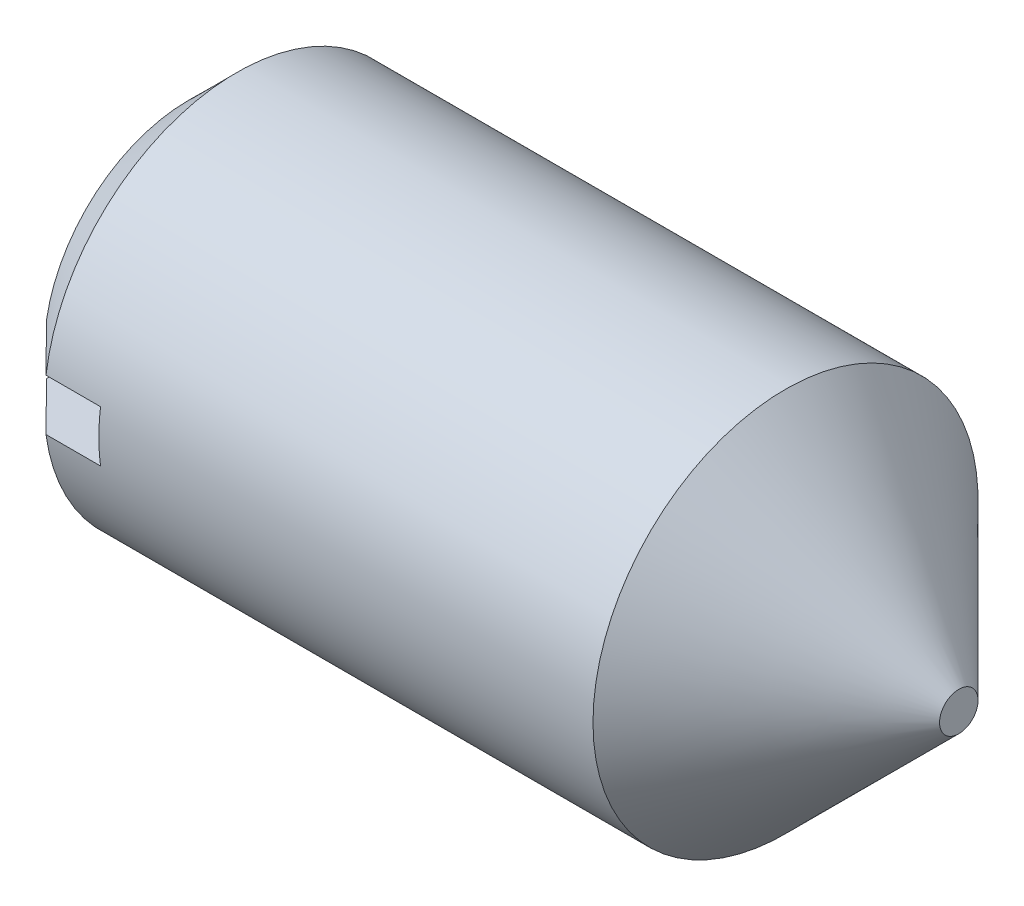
SolidWorks part; units mm, degrees
ref_plane "Front" through (0, 0, 0) normal (0, 0, 1) x (1, 0, 0)
ref_plane "Top" through (0, 0, 0) normal (0, 1, 0) x (1, 0, 0)
ref_plane "Right" through (0, 0, 0) normal (1, 0, 0) x (0, 0, -1)
sketch "Sketch1" plane through (0, 0, 0) normal (0, 0, 1) x (1, 0, 0)
  line L0 (0, 0) -> (6, 0)
  line L1 (6, 0) -> (6, 0.15)
  line L2 (6, 0.15) -> (4.65, 1.5)
  line L3 (4.65, 1.5) -> (0.375, 1.5)
  line L4 (0.375, 1.5) -> (0, 1.125)
  line L5 (0, 1.125) -> (0, 0)
  line L6 (-14.7741, 0) -> (12.5137, 0) construction
  dimension "D1" = 45
  dimension "l" = 6
  dimension "D2" = 45
  dimension "dt" = 0.3
  dimension "d" = 3
  dimension "df" = 2.25
revolve "Base" add sketch "Sketch1" angle 360 about L6
sketch "Sketch2" plane through (0, 0, 0) normal (0, 0, 1) x (1, 0, 0)
  line L1 (0, 0.2) -> (0.8, 0.2)
  line L2 (0, 0.2) -> (0, -0.2)
  line L3 (0, -0.2) -> (0.8, -0.2)
  line L4 (0.8, 0.2) -> (0.8, -0.2)
  line L5 (0, 1.125) -> (0, -1.125) construction
  dimension "m" = 0.2
  dimension "n" = 0.4
  dimension "t" = 0.8
extrude "Notch" cut sketch "Sketch2" against normal through all and the other way through all
sketch "Sketch3" plane through (0, 0, 0) normal (0, 0, 1) x (1, 0, 0)
  line L0 (0.375, 1.1752) -> (0.5625, 1.5)
  line L1 (0.5625, 1.5) -> (0.5625, 1.875)
  line L2 (0.5625, 1.875) -> (0.1875, 1.875)
  line L3 (0.1875, 1.875) -> (0.1875, 1.5)
  line L4 (0.1875, 1.5) -> (0.375, 1.1752)
  line L5 (0, 0) -> (2.4208, 0) construction
  line L6 (0.375, 1.5) -> (0.375, 0.2) construction
  dimension "D1" = 3
  dimension "D2" = 0.375
revolve "Cut-Revolve10" [suppressed] cut sketch "Sketch3" angle 360 about L5
pattern_linear "LPattern10" [suppressed] count 13 spacing 0.45 along (1, 0, 0)
equation "\"df@Sketch1\" = \"D2@ThreadCosmetic1\""
equation "\"m@Sketch2\" = \"n@Sketch2\" / 2"
equation "\"D1@Sketch3\" = \"d@Sketch1\""
equation "\"D2@Sketch3\" =  ( \"d@Sketch1\" - \"D2@ThreadCosmetic1\" )  / 2"
equation "\"D3@LPattern10\" = \"D2@Sketch3\" * 1.2"
equation "\"D1@LPattern10\" =  ( \"l@Sketch1\" -  ( \"d@Sketch1\" - \"df@Sketch1\" )  / 2 )  / \"D3@LPattern10\""
